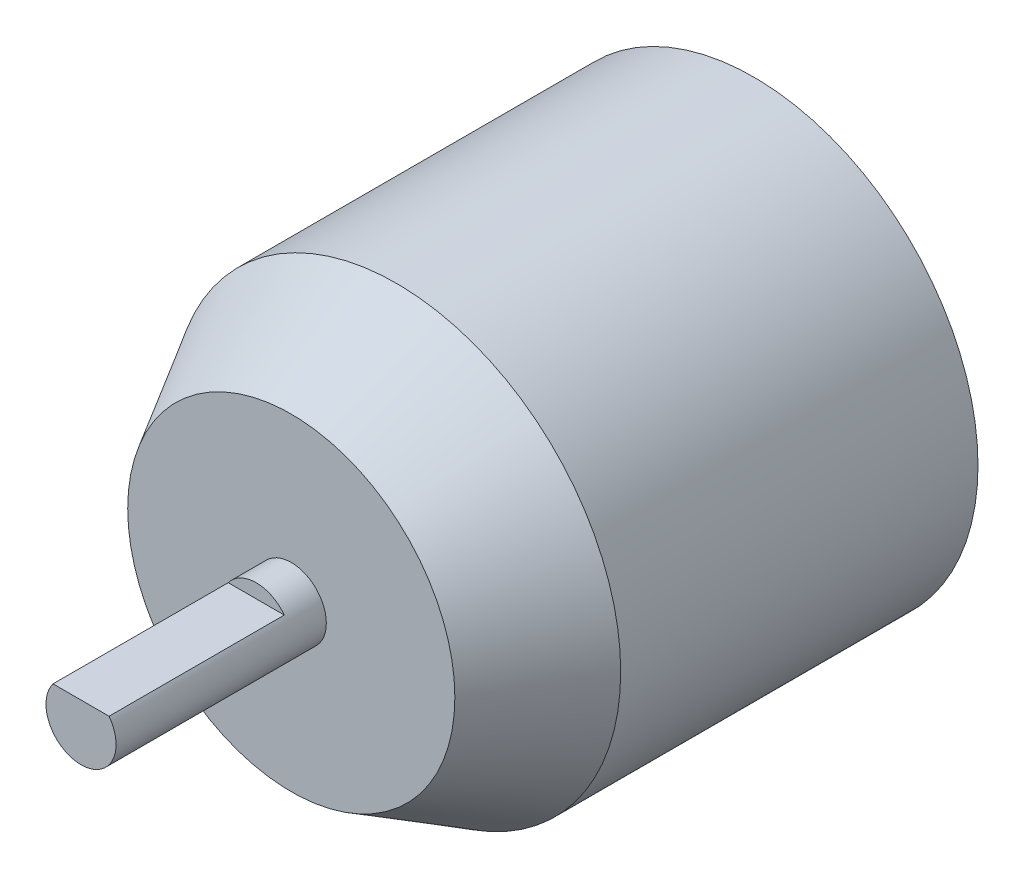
SolidWorks part; units mm, degrees
ref_plane "Alzado" through (0, 0, 0) normal (0, 0, 1) x (1, 0, 0)
ref_plane "Planta" through (0, 0, 0) normal (0, 1, 0) x (1, 0, 0)
ref_plane "Vista lateral" through (0, 0, 0) normal (1, 0, 0) x (0, 0, -1)
sketch "Croquis1" plane through (0, 0, 0) normal (0, 0, 1) x (1, 0, 0)
  circle A0 centre (0, 0) radius 32
  dimension "D1" = 64
extrude "Saliente-Extruir1" add sketch "Croquis1" along normal blind 70
sketch "Croquis2" plane through (0, 0, 70) normal (0, 0, 1) x (1, 0, 0)
  circle A0 centre (0, 0) radius 5
  dimension "D1" = 10
extrude "Saliente-Extruir2" add sketch "Croquis2" along normal blind 30
chamfer "Chaflán1" distance 15 angle 30 1 edges at (32, 0, 70)
chamfer "Chaflán2" distance 15 angle 15 1 edges at (32, 0, 0)
sketch "Croquis3" plane through (0, 0, 100) normal (0, 0, 1) x (1, 0, 0)
  line L0 (0, -5) -> (0, 3) construction
  line L1 (-33.0199, 3) -> (33.0199, 3)
  line L2 (-33.0199, 3) -> (-33.0199, 11.0493)
  line L3 (-33.0199, 11.0493) -> (33.0199, 11.0493)
  line L4 (33.0199, 3) -> (33.0199, 11.0493)
  circle A0 centre (0, 0) radius 5 construction
  circle A1 centre (0, 0) radius 5 construction
  dimension "D1" = 8
extrude "Cortar-Extruir1" cut sketch "Croquis3" against normal blind 25
